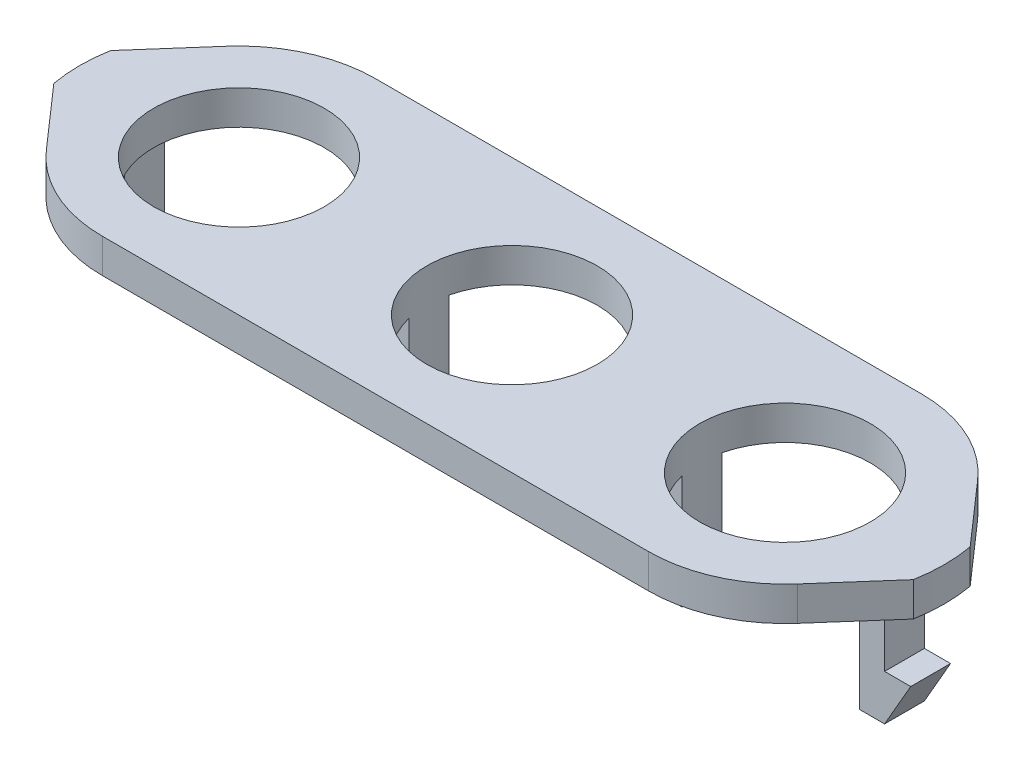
SolidWorks part; units mm, degrees
ref_plane "Front Plane" through (0, 0, 0) normal (0, 0, 1) x (1, 0, 0)
ref_plane "Top Plane" through (0, 0, 0) normal (0, 1, 0) x (1, 0, 0)
ref_plane "Right Plane" through (0, 0, 0) normal (1, 0, 0) x (0, 0, -1)
sketch "Sketch1" plane through (0, 0, 0) normal (0, 1, 0) x (1, 0, 0)
  line L0 (37.775, -2.5) -> (33.0167, -7.9183)
  line L1 (37.775, 2.5) -> (33.0167, 7.9183)
  line L2 (24, 12) -> (-24, 12)
  line L3 (-37.775, -2.5) -> (-33.0167, -7.9183)
  line L4 (-12, 9.4167) -> (-2.8534, 11.6558)
  line L5 (-12, -9.4167) -> (-2.8534, -11.6558)
  line L6 (-12, -9.4167) -> (-21.1466, -11.6558)
  line L7 (-12, 9.4167) -> (-21.1466, 11.6558)
  line L8 (-37.775, 2.5) -> (-33.0167, 7.9183)
  line L9 (12, -9.4167) -> (2.8534, -11.6558)
  line L10 (12, -9.4167) -> (21.1466, -11.6558)
  line L11 (12, 9.4167) -> (21.1466, 11.6558)
  line L12 (12, 9.4167) -> (2.8534, 11.6558)
  line L13 (24, -12) -> (-24, -12)
  arc A0 (-37.775, -2.5) -> (-37.775, 2.5) centre (-24, 0) cw
  arc A1 (-2.8534, -11.6558) -> (2.8534, -11.6558) centre (0, 0) ccw
  arc A2 (21.1466, 11.6558) -> (33.0167, 7.9183) centre (24, 0) cw
  circle A3 centre (24, 0) radius 7.5
  arc A4 (-21.1466, -11.6558) -> (-33.0167, -7.9183) centre (-24, 0) cw
  circle A5 centre (-24, 0) radius 7.5
  arc A6 (2.8534, 11.6558) -> (-2.8534, 11.6558) centre (0, 0) ccw
  circle A7 centre (0, 0) radius 7.5
  arc A8 (37.775, -2.5) -> (37.775, 2.5) centre (24, 0) ccw
  arc A9 (33.0167, -7.9183) -> (21.1466, -11.6558) centre (24, 0) cw
  arc A10 (-33.0167, 7.9183) -> (-21.1466, 11.6558) centre (-24, 0) cw
  dimension "D2" = 24
  dimension "D3" = 15
  dimension "D4" = 15
  dimension "D5" = 15
extrude "Boss-Extrude2" add sketch "Sketch1" along normal blind 3 contours A10 L8 A0 L3 A4 L6 L5 A1 L9 L10 A9 L0 A8 L1 A2 L11 L12 A6 L4 L7 A7 A5 A3 | L6 A4 L13 A1 L5 | L13 A9 L10 L9 A1 | A6 L12 L11 A2 L2 | L2 A10 L7 L4 A6
sketch "Sketch2" plane through (0, 0, 0) normal (0, -1, 0) x (1, 0, 0)
  line L0 (16.707, 1.75) -> (7.293, 1.75)
  line L1 (16.707, -1.75) -> (7.293, -1.75)
  line L2 (-34.5, 1.75) -> (-34.5, 0)
  line L3 (-7.293, -1.75) -> (-16.707, -1.75)
  line L4 (-34.5, -1.75) -> (-34.5, 0)
  line L5 (-7.293, 1.75) -> (-16.707, 1.75)
  line L6 (-31.293, 1.75) -> (-34.5, 1.75)
  line L7 (-31.293, -1.75) -> (-34.5, -1.75)
  line L8 (34.5, 1.75) -> (34.5, 0)
  line L9 (34.5, -1.75) -> (34.5, 0)
  line L14 (34.5, -1.75) -> (31.293, -1.75)
  line L15 (34.5, 1.75) -> (31.293, 1.75)
  circle A0 centre (-24, 0) radius 7.5 construction
  arc A1 (31.293, -1.75) -> (31.293, 1.75) centre (24, 0) ccw
  arc A3 (-7.293, 1.75) -> (-7.293, -1.75) centre (0, 0) ccw
  circle A4 centre (0, 0) radius 7.5 construction
  circle A5 centre (24, 0) radius 7.5 construction
  arc A6 (-16.707, -1.75) -> (-16.707, 1.75) centre (-24, 0) ccw
  arc A7 (7.293, -1.75) -> (7.293, 1.75) centre (0, 0) ccw
  arc A8 (16.707, 1.75) -> (16.707, -1.75) centre (24, 0) ccw
  arc A9 (-31.293, 1.75) -> (-31.293, -1.75) centre (-24, 0) ccw
extrude "Boss-Extrude4" add sketch "Sketch2" along normal blind 10
sketch "Sketch4" plane through (0, 0, -1.75) normal (0, 0, -1) x (-1, 0, 0)
  line L0 (34.5, -10) -> (34.5, -6)
  line L1 (34.5, -10) -> (34.5, 0) construction
  line L2 (34.5, -6) -> (36.8, -6)
  line L3 (34.5, -10) -> (36.8, -6)
  line L5 (-34.5, -10) -> (-36.8, -6)
  line L6 (-34.5, -6) -> (-36.8, -6)
  line L7 (-34.5, -10) -> (-34.5, -6)
  dimension "D1" = 4
  dimension "D2" = 2.3
extrude "Boss-Extrude5" add sketch "Sketch4" against normal up to surface (3.5 mm away)
sketch "Sketch5" plane through (0, -10, 0) normal (0, -1, 0) x (1, 0, 0)
  line L0 (-31.293, 1.75) -> (-32.293, 1.75)
  line L1 (-31.293, 1.75) -> (-34.5, 1.75) construction
  line L2 (-32.293, 1.75) -> (-32.293, -1.75)
  line L3 (-34.5, 1.75) -> (-34.5, -1.75)
  line L4 (-34.5, -1.75) -> (-31.293, -1.75)
  line L5 (-31.293, 1.75) -> (-34.5, 1.75)
  line L6 (-34.5, -1.75) -> (-31.293, -1.75) construction
  line L7 (-31.293, -1.75) -> (-32.293, -1.75)
  line L8 (0, 0) -> (0, 8.4881)
  line L9 (31.293, -1.75) -> (32.293, -1.75)
  line L10 (32.293, 1.75) -> (32.293, -1.75)
  line L11 (31.293, 1.75) -> (32.293, 1.75)
  arc A1 (-31.293, 1.75) -> (-31.293, -1.75) centre (-24, 0) ccw
  arc A2 (-31.293, 1.75) -> (-31.293, -1.75) centre (-24, 0) ccw
  arc A3 (31.293, 1.75) -> (31.293, -1.75) centre (24, 0) cw
  dimension "D2" = 1
  dimension "D1" = 0
extrude "Cut-Extrude1" cut sketch "Sketch5" against normal up to surface (10 mm away) contours L2 M8 M6 M7 | L10 L9 A3 L11
